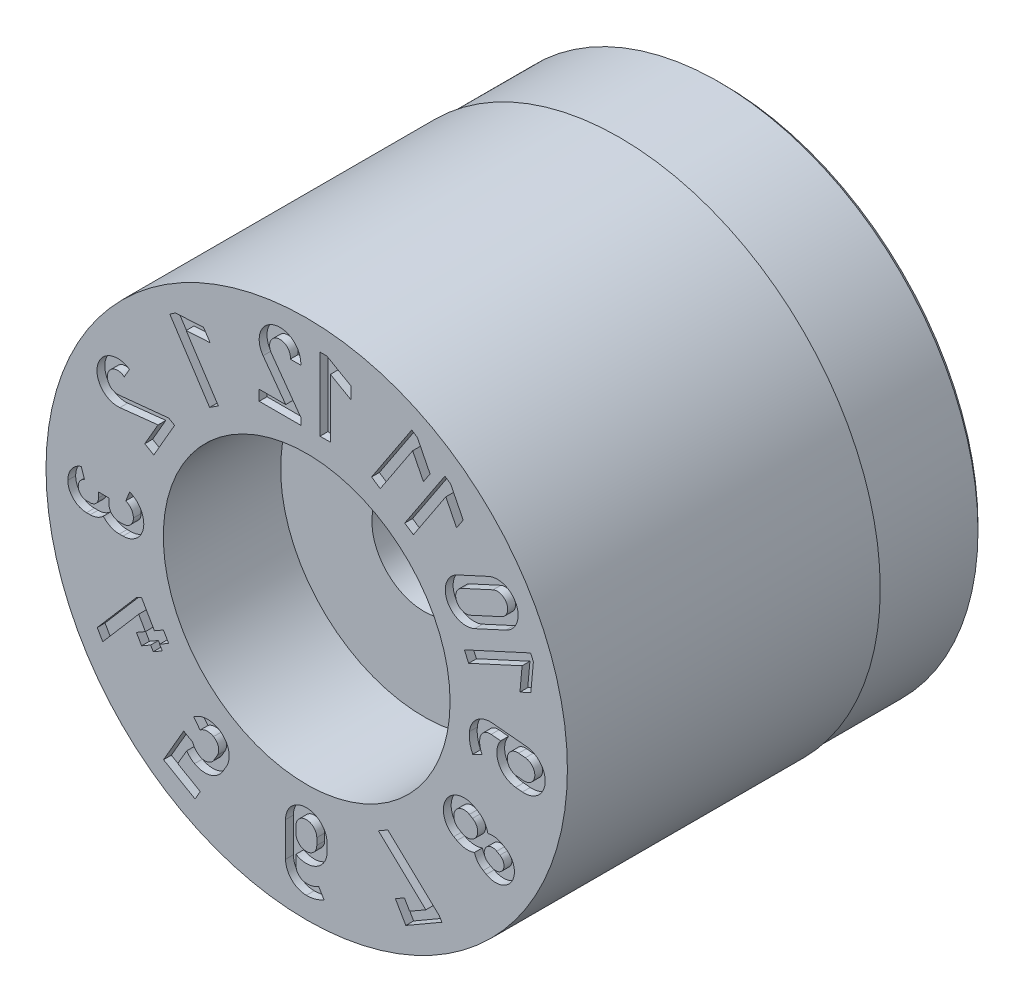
SolidWorks part; units mm, degrees
ref_plane "Front Plane" through (0, 0, 0) normal (0, 0, 1) x (1, 0, 0)
ref_plane "Top Plane" through (0, 0, 0) normal (0, 1, 0) x (1, 0, 0)
ref_plane "Right Plane" through (0, 0, 0) normal (1, 0, 0) x (0, 0, -1)
sketch "Sketch1" plane through (0, 0, 0) normal (1, 0, 0) x (0, 0, -1)
  line L2 (0, 10) -> (0, 5.5)
  line L3 (15.75, 10) -> (0, 10)
  line L4 (-3.7979, 0) -> (49996.2021, 0) construction
  line L8 (16, 2) -> (4.5, 2)
  line L9 (4.5, 5.5) -> (4.5, 2)
  line L10 (4.5, 5.5) -> (0, 5.5)
  line L12 (16, 2) -> (16, 9.75)
  line L16 (16, 9.75) -> (15.75, 10)
  dimension "D1" = 16
  dimension "D2" = 45
  dimension "D3" = 0.25
  dimension "D4" = 20
  dimension "D5" = 11
  dimension "D6" = 4.5
  dimension "D7" = 4
revolve "Revolve1" add sketch "Sketch1" angle 360 about L4
sketch "Sketch4" plane through (0, 0, 0) normal (1, 0, 0) x (0, 0, -1)
  line L0 (0, 0) -> (50000, 0) construction
  line L1 (16, -9.75) -> (16, 9.75) construction
  line L2 (12, 10.935) -> (16, 10.935)
  line L3 (12, 10.935) -> (12, 9.935)
  line L4 (12, 9.935) -> (16, 9.935)
  line L5 (16, 10.935) -> (16, 9.935)
  line L6 (15.75, 10) -> (0, 10) construction
  line L9 (0, 55) -> (0, -55) construction
  dimension "D1" = 1
  dimension "D2" = 0.065
  dimension "D3" = 12
revolve "Cut-Revolve1" cut sketch "Sketch4" angle 360 about L0
sketch "Sketch2" plane through (0, 0, 0) normal (0, 0, 1) x (1, 0, 0)
  line L959 (5.3001, 7.3965) -> (5.5193, 7.2517)
  line L960 (5.5193, 7.2517) -> (6.0027, 6.2879)
  line L961 (6.0027, 6.2879) -> (5.7489, 5.9038)
  line L962 (5.7489, 5.9038) -> (5.3359, 6.7269)
  line L963 (5.3359, 6.7269) -> (4.0924, 4.8454)
  line L964 (4.0924, 4.8454) -> (3.7594, 5.0655)
  line L965 (3.7594, 5.0655) -> (5.3001, 7.3965)
  line L966 (4.029, 8.2931) -> (4.2482, 8.1482)
  line L967 (4.2482, 8.1482) -> (4.7316, 7.1844)
  line L968 (4.7316, 7.1844) -> (4.4778, 6.8004)
  line L969 (4.4778, 6.8004) -> (4.0648, 7.6234)
  line L970 (4.0648, 7.6234) -> (2.8213, 5.742)
  line L971 (2.8213, 5.742) -> (2.4883, 5.962)
  line L972 (2.4883, 5.962) -> (4.029, 8.2931)
  line L973 (6.281, 3.2668) -> (7.4781, 3.8166)
  line L974 (7.1448, 4.5421) -> (5.9477, 3.9923)
  line L975 (8.3874, -0.4156) -> (8.1292, -0.3915)
  line L976 (8.055, -1.1864) -> (8.3132, -1.2105)
  line L977 (8.4245, -0.018) -> (7.113, 0.1041)
  line L978 (6.3682, -1.3097) -> (6.7286, -1.1365)
  line L979 (8.2757, -1.6078) -> (8.0178, -1.5846)
  line L980 (7.4406, -0.3273) -> (7.0758, -0.2933)
  line L981 (6.9694, -4.6227) -> (7.0904, -4.6924)
  line L982 (7.4098, -4.1393) -> (7.2888, -4.0694)
  line L983 (2.7506, -5.6595) -> (3.1114, -5.4512)
  line L984 (3.1114, -5.4512) -> (5.0889, -7.3147)
  line L985 (5.0889, -7.3147) -> (5.1847, -7.4806)
  line L986 (5.1847, -7.4806) -> (3.8019, -8.2789)
  line L987 (3.8019, -8.2789) -> (3.4028, -7.5876)
  line L988 (3.4028, -7.5876) -> (3.7485, -7.3879)
  line L989 (3.7485, -7.3879) -> (3.9481, -7.7336)
  line L990 (3.9481, -7.7336) -> (4.5702, -7.3744)
  line L991 (4.5702, -7.3744) -> (2.7506, -5.6595)
  line L992 (5.8406, -4.063) -> (5.9617, -4.1329)
  line L993 (6.3607, -3.4415) -> (6.2398, -3.3715)
  line L994 (6.5603, -3.0958) -> (6.4395, -3.0258)
  line L995 (5.6411, -4.4086) -> (5.762, -4.4784)
  line L996 (6.7699, -4.9683) -> (6.8909, -5.0381)
  line L997 (7.6091, -3.7939) -> (7.4884, -3.7237)
  line L998 (8.5862, 3.1662) -> (8.6959, 2.9274)
  line L999 (8.6959, 2.9274) -> (8.5976, 1.8537)
  line L1000 (8.5976, 1.8537) -> (8.1792, 1.6615)
  line L1001 (8.1792, 1.6615) -> (8.2631, 2.5786)
  line L1002 (8.2631, 2.5786) -> (6.2137, 1.6373)
  line L1003 (6.2137, 1.6373) -> (6.0471, 2)
  line L1004 (6.0471, 2) -> (8.5862, 3.1662)
  line L1005 (6.9781, 4.9049) -> (5.7811, 4.3552)
  line L1006 (6.4476, 2.904) -> (7.6446, 3.4538)
  line L1007 (0.511, 9.1227) -> (0.7738, 9.1227)
  line L1008 (0.7738, 9.1227) -> (1.7085, 8.5852)
  line L1009 (1.7085, 8.5852) -> (1.7085, 8.1248)
  line L1010 (1.7085, 8.1248) -> (0.9101, 8.5837)
  line L1011 (0.9101, 8.5837) -> (0.9101, 6.3285)
  line L1012 (0.9101, 6.3285) -> (0.511, 6.3285)
  line L1013 (0.511, 6.3285) -> (0.511, 9.1227)
  line L1014 (-1.8228, 6.3224) -> (-0.2261, 6.3224)
  line L1015 (-0.2261, 6.3224) -> (-0.2261, 6.5864)
  line L1016 (-0.2261, 6.5864) -> (-1.3486, 8.1447)
  line L1017 (-0.6298, 8.3182) -> (-0.2283, 8.3182)
  line L1018 (-1.673, 7.9111) -> (-0.8048, 6.7216)
  line L1019 (-0.8048, 6.7216) -> (-1.8228, 6.7216)
  line L1020 (-1.8228, 6.7216) -> (-1.8228, 6.3224)
  line L1021 (-5.2532, 7.5052) -> (-5.0333, 7.6491)
  line L1022 (-5.0333, 7.6491) -> (-3.9569, 7.7113)
  line L1023 (-3.9569, 7.7113) -> (-3.7047, 7.3261)
  line L1024 (-3.7047, 7.3261) -> (-4.6241, 7.2728)
  line L1025 (-4.6241, 7.2728) -> (-3.389, 5.3859)
  line L1026 (-3.389, 5.3859) -> (-3.7229, 5.1673)
  line L1027 (-3.7229, 5.1673) -> (-5.2532, 7.5052)
  line L1028 (-0.4118, -7.069) -> (-0.4118, -7.3284)
  line L1029 (0.3866, -7.3284) -> (0.3866, -7.069)
  line L1030 (0.7856, -7.0695) -> (0.7865, -7.3284)
  line L1031 (-0.4117, -8.0199) -> (-0.4118, -8.3863)
  line L1032 (-0.8111, -7.0689) -> (-0.8109, -8.3862)
  line L1033 (0.666, -8.9964) -> (0.46, -8.6536)
  line L1034 (-4.606, -6.6835) -> (-4.947, -7.2741)
  line L1035 (-4.947, -7.2741) -> (-4.0827, -7.7731)
  line L1036 (-4.0827, -7.7731) -> (-4.2823, -8.1189)
  line L1037 (-4.2823, -8.1189) -> (-5.4922, -7.4203)
  line L1038 (-5.4922, -7.4203) -> (-4.7175, -6.0784)
  line L1039 (-4.7175, -6.0784) -> (-4.3718, -6.278)
  line L1040 (-3.5572, -6.4634) -> (-3.4273, -6.2388)
  line L1041 (-4.0886, -5.7317) -> (-4.3371, -5.4189)
  line L1042 (-3.0817, -6.4383) -> (-3.2117, -6.6628)
  line L1043 (-7.0472, -0.37) -> (-7.187, -0.37)
  line L1044 (-7.586, 0.0291) -> (-7.586, 0.2286)
  line L1045 (-7.586, 0.2286) -> (-7.9853, 0.2286)
  line L1046 (-7.9853, 0.2286) -> (-7.9853, 0.0291)
  line L1047 (-8.3046, -0.2902) -> (-8.4443, -0.2902)
  line L1048 (-8.5194, 0.3695) -> (-8.6471, 0.7477)
  line L1049 (-8.4442, -0.6894) -> (-8.3046, -0.6894)
  line L1050 (-7.1869, -0.7692) -> (-7.0472, -0.7692)
  line L1051 (-6.7922, 0.8275) -> (-6.9387, 0.4563)
  line L1052 (-8.0353, -4.2998) -> (-7.8239, -4.666)
  line L1053 (-7.8239, -4.666) -> (-6.4448, -3.0631)
  line L1054 (-6.4448, -3.0631) -> (-6.1862, -3.511)
  line L1055 (-6.1862, -3.511) -> (-6.5318, -3.7105)
  line L1056 (-6.5318, -3.7105) -> (-6.3323, -4.0562)
  line L1057 (-6.3323, -4.0562) -> (-5.9866, -3.8566)
  line L1058 (-5.9866, -3.8566) -> (-5.8868, -4.0295)
  line L1059 (-5.8868, -4.0295) -> (-5.5412, -3.8299)
  line L1060 (-5.5412, -3.8299) -> (-5.641, -3.6571)
  line L1061 (-5.641, -3.6571) -> (-5.2952, -3.4575)
  line L1062 (-5.2952, -3.4575) -> (-5.4948, -3.1118)
  line L1063 (-5.4948, -3.1118) -> (-5.8405, -3.3114)
  line L1064 (-5.8405, -3.3114) -> (-6.3395, -2.4472)
  line L1065 (-6.3395, -2.4472) -> (-6.5416, -2.5638)
  line L1066 (-6.5416, -2.5638) -> (-8.0353, -4.2998)
  line L1067 (-6.2115, 2.7157) -> (-5.8658, 2.5161)
  line L1068 (-5.8658, 2.5161) -> (-5.0674, 3.8989)
  line L1069 (-5.0674, 3.8989) -> (-5.296, 4.0309)
  line L1070 (-5.296, 4.0309) -> (-7.2068, 3.838)
  line L1071 (-6.9977, 4.5472) -> (-6.7969, 4.8949)
  line L1072 (-7.1667, 3.4402) -> (-5.7025, 3.5973)
  line L1073 (-5.7025, 3.5973) -> (-6.2115, 2.7157)
  arc A462 (5.9477, 3.9923) -> (6.281, 3.2668) centre (6.1143, 3.6296) ccw
  arc A463 (7.4781, 3.8166) -> (7.1448, 4.5421) centre (7.3114, 4.1794) ccw
  arc A464 (8.1292, -0.3915) -> (8.055, -1.1864) centre (8.0921, -0.789) ccw
  arc A465 (8.3132, -1.2105) -> (8.3874, -0.4156) centre (8.3503, -0.8131) ccw
  arc A466 (7.113, 0.1041) -> (6.2439, -0.6165) centre (7.0389, -0.6909) ccw
  arc A467 (6.2439, -0.6165) -> (6.3682, -1.3097) centre (7.5544, -0.7392) ccw
  arc A468 (8.2757, -1.6078) -> (8.4245, -0.018) centre (8.3501, -0.8129) ccw
  arc A469 (7.4406, -0.3273) -> (8.0178, -1.5846) centre (8.0891, -0.7908) ccw
  arc A470 (7.0758, -0.2933) -> (6.6453, -0.6233) centre (7.0387, -0.6906) ccw
  arc A471 (6.6453, -0.6233) -> (6.7286, -1.1365) centre (7.4349, -0.7585) ccw
  arc A472 (7.2888, -4.0694) -> (6.9694, -4.6227) centre (7.1287, -4.3458) ccw
  arc A473 (7.0904, -4.6924) -> (7.4098, -4.1393) centre (7.2501, -4.4159) ccw
  arc A474 (6.2398, -3.3715) -> (5.8406, -4.063) centre (6.0404, -3.7173) ccw
  arc A475 (5.9617, -4.1329) -> (6.3607, -3.4415) centre (6.1612, -3.7872) ccw
  arc A476 (6.9478, -3.6507) -> (6.5603, -3.0958) centre (6.1612, -3.7872) ccw
  arc A477 (6.4395, -3.0258) -> (5.6411, -4.4086) centre (6.0397, -3.7169) ccw
  arc A478 (5.762, -4.4784) -> (6.4363, -4.5365) centre (6.1612, -3.7872) ccw
  arc A479 (6.4363, -4.5365) -> (6.7699, -4.9683) centre (7.1299, -4.3455) ccw
  arc A480 (6.8909, -5.0381) -> (7.6091, -3.7939) centre (7.25, -4.416) ccw
  arc A481 (7.4884, -3.7237) -> (6.9478, -3.6507) centre (7.13, -4.3399) ccw
  arc A482 (5.7811, 4.3552) -> (6.4476, 2.904) centre (6.1143, 3.6296) ccw
  arc A483 (7.6446, 3.4538) -> (6.9781, 4.9049) centre (7.3114, 4.1794) ccw
  arc A484 (-0.6298, 8.3182) -> (-1.3486, 8.1447) centre (-1.0246, 8.3781) ccw
  arc A485 (-0.2283, 8.3182) -> (-1.673, 7.9111) centre (-1.0248, 8.3777) ccw
  arc A486 (-0.4118, -7.3284) -> (0.3866, -7.3284) centre (-0.0126, -7.3284) ccw
  arc A487 (0.3866, -7.069) -> (-0.4118, -7.069) centre (-0.0126, -7.069) ccw
  arc A488 (0.7856, -7.0695) -> (-0.8111, -7.0689) centre (-0.0128, -7.0692) ccw
  arc A489 (-0.4117, -8.0199) -> (0.7865, -7.3284) centre (-0.0106, -7.3311) ccw
  arc A490 (-0.4118, -8.3863) -> (-0.0432, -8.7842) centre (-0.0127, -8.3863) ccw
  arc A491 (-0.0432, -8.7842) -> (0.46, -8.6536) centre (0.0181, -7.9855) ccw
  arc A492 (-0.8109, -8.3862) -> (-0.0126, -9.1846) centre (-0.0124, -8.3861) ccw
  arc A493 (-0.0126, -9.1846) -> (0.666, -8.9964) centre (-0.0122, -7.8684) ccw
  arc A494 (-4.3718, -6.278) -> (-4.1024, -6.6096) centre (-3.8026, -6.0907) ccw
  arc A495 (-4.1024, -6.6096) -> (-3.5572, -6.4634) centre (-3.9028, -6.2641) ccw
  arc A496 (-3.4273, -6.2388) -> (-3.5735, -5.6935) centre (-3.7728, -6.0392) ccw
  arc A497 (-3.5735, -5.6935) -> (-4.0886, -5.7317) centre (-3.803, -6.0915) ccw
  arc A498 (-3.3739, -5.3478) -> (-4.3371, -5.4189) centre (-3.8033, -6.0903) ccw
  arc A499 (-3.0817, -6.4383) -> (-3.3739, -5.3478) centre (-3.7738, -6.0394) ccw
  arc A500 (-4.302, -6.9552) -> (-3.2117, -6.6628) centre (-3.9035, -6.2622) ccw
  arc A501 (-4.606, -6.6835) -> (-4.302, -6.9552) centre (-3.8087, -6.0974) ccw
  arc A502 (-6.6481, 0.0292) -> (-6.9387, 0.4563) centre (-7.1072, 0.0292) ccw
  arc A503 (-7.0472, -0.37) -> (-6.6481, 0.0292) centre (-7.0472, 0.0292) ccw
  arc A504 (-7.586, 0.0291) -> (-7.187, -0.37) centre (-7.187, 0.0291) ccw
  arc A505 (-8.3046, -0.2902) -> (-7.9853, 0.0291) centre (-8.3046, 0.0291) ccw
  arc A506 (-8.7636, 0.0291) -> (-8.4443, -0.2902) centre (-8.444, 0.0294) ccw
  arc A507 (-8.5194, 0.3695) -> (-8.7636, 0.0291) centre (-8.4048, 0.0295) ccw
  arc A508 (-8.6471, 0.7477) -> (-9.1628, 0.0292) centre (-8.4042, 0.029) ccw
  arc A509 (-9.1628, 0.0292) -> (-8.4442, -0.6894) centre (-8.4443, 0.029) ccw
  arc A510 (-8.3046, -0.6894) -> (-7.8, -0.4823) centre (-8.3046, 0.0288) ccw
  arc A511 (-7.8, -0.4823) -> (-7.1869, -0.7692) centre (-7.1871, 0.0288) ccw
  arc A512 (-7.0472, -0.7692) -> (-6.249, 0.0291) centre (-7.0472, 0.029) ccw
  arc A513 (-6.249, 0.0291) -> (-6.7922, 0.8275) centre (-7.1074, 0.029) ccw
  arc A514 (-6.9977, 4.5472) -> (-7.2068, 3.838) centre (-7.2469, 4.2352) ccw
  arc A515 (-6.7969, 4.8949) -> (-7.1667, 3.4402) centre (-7.2467, 4.2349) ccw
  point P1872 (0, 0.0155)
  point P1873 (0.0155, 0.0155)
  point P1874 (0.0155, 0)
extrude "Cut-Extrude1" cut sketch "Sketch2" against normal blind 0.3
